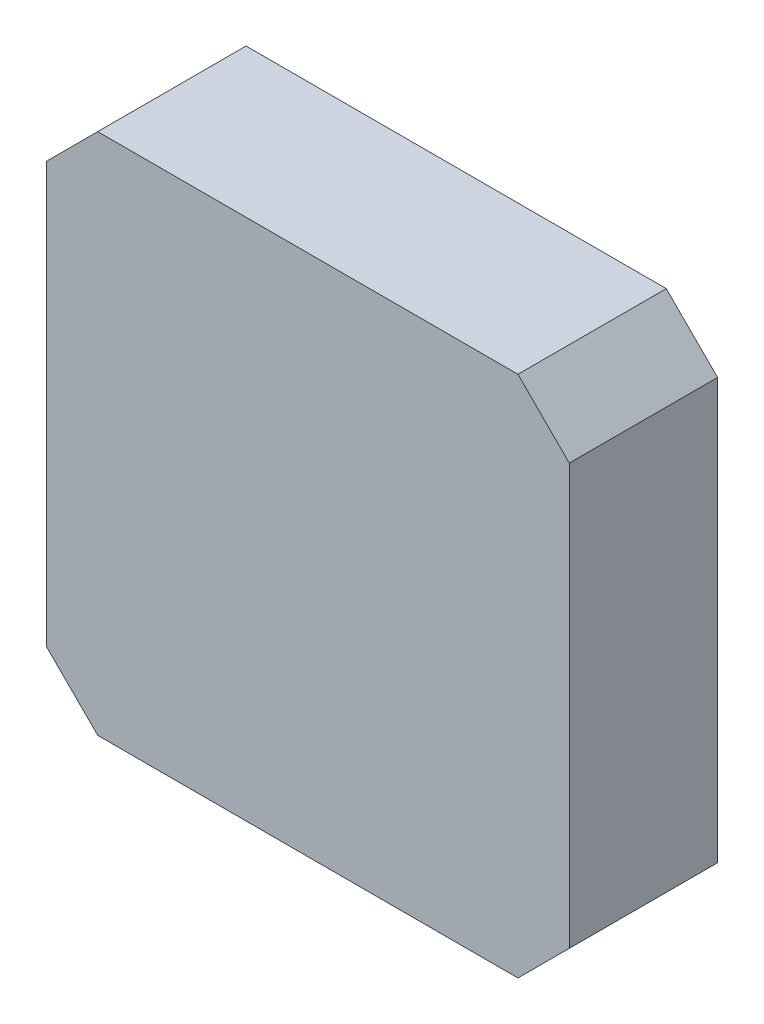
SolidWorks part; units mm, degrees
ref_plane "Alzado" through (0, 0, 0) normal (0, 0, 1) x (1, 0, 0)
ref_plane "Planta" through (0, 0, 0) normal (0, 1, 0) x (1, 0, 0)
ref_plane "Vista lateral" through (0, 0, 0) normal (1, 0, 0) x (0, 0, -1)
sketch "Croquis1" plane through (0, 0, 0) normal (0, 0, 1) x (1, 0, 0)
  line L1 (-21.15, -17) -> (-17, -21.15) construction
  line L2 (21.15, 17) -> (17, 21.15) construction
  line L3 (17, -21.15) -> (21.15, -17) construction
  line L4 (21.15, -17) -> (17, -21.15)
  line L5 (-17, -21.15) -> (-21.15, -17)
  line L6 (-21.15, 17) -> (-17, 21.15)
  line L7 (17, 21.15) -> (21.15, 17)
  line L8 (-21.15, 17) -> (-21.15, -17)
  line L9 (-17, -21.15) -> (17, -21.15)
  line L10 (21.15, -17) -> (21.15, 17)
  line L11 (17, 21.15) -> (-17, 21.15)
  line L12 (-17, 21.15) -> (-21.15, 17) construction
  line L14 (-17, 21.15) -> (-10, 21.15) construction
  point P16 (-18.5327, 19.6173)
extrude "Saliente-Extruir1" add sketch "Croquis1" along normal blind 12
sketch "Croquis2" plane through (0, 0, 0) normal (0, 0, -1) x (-1, 0, 0)
  line L1 (15.5, -15.5) -> (-15.5, -15.5) construction
  line L2 (15.5, -15.5) -> (15.5, 15.5) construction
  line L3 (15.5, 15.5) -> (-15.5, 15.5) construction
  line L4 (-15.5, -15.5) -> (-15.5, 15.5) construction
  line L5 (15.5, -15.5) -> (-15.5, 15.5) construction
  line L6 (15.5, 15.5) -> (-15.5, -15.5) construction
  circle A0 centre (15.5, 15.5) radius 1.5
  circle A1 centre (15.5, -15.5) radius 1.5
  circle A2 centre (0, 0) radius 1.5
  circle A3 centre (-15.5, 15.5) radius 1.5
  circle A4 centre (-15.5, -15.5) radius 1.5
  point P0 (0, 0)
  dimension "D1" = 3
extrude "Saliente-Extruir2" add sketch "Croquis2" along normal blind 3
fillet "Redondeo1" radius 1 5 edges at (-17, -15.5, -3) (-17, 15.5, -3) (14, 15.5, -3) (14, -15.5, -3) (-1.5, 0, -3)
